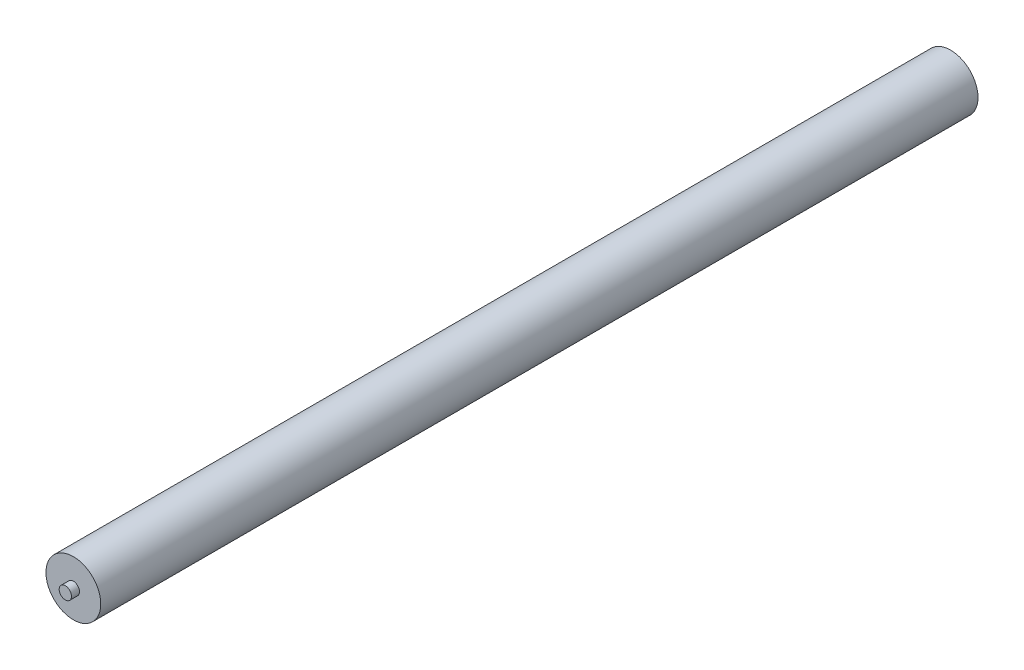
SolidWorks part; units mm, degrees
ref_plane "Front" through (0, 0, 0) normal (0, 0, 1) x (1, 0, 0)
ref_plane "Top" through (0, 0, 0) normal (0, 1, 0) x (1, 0, 0)
ref_plane "Right" through (0, 0, 0) normal (1, 0, 0) x (0, 0, -1)
sketch "Esquisse1" plane through (0, 0, 0) normal (0, 0, 1) x (1, 0, 0)
  circle A0 centre (0, 0) radius 44.5
  dimension "D2" = 89
extrude "Base-Extrusion" add sketch "Esquisse1" along normal blind 1425
sketch "Esquisse2" plane through (0, 0, 1425) normal (0, 0, 1) x (1, 0, 0)
  circle A0 centre (0, 0) radius 10
  dimension "D1" = 20
extrude "Boss.-Extru.1" add sketch "Esquisse2" along normal blind 13
sketch "Esquisse3" plane through (0, 0, 0) normal (0, 0, -1) x (-1, 0, 0)
  circle A0 centre (0, 0) radius 10
  dimension "D1" = 20
extrude "Boss.-Extru.2" add sketch "Esquisse3" along normal blind 13
